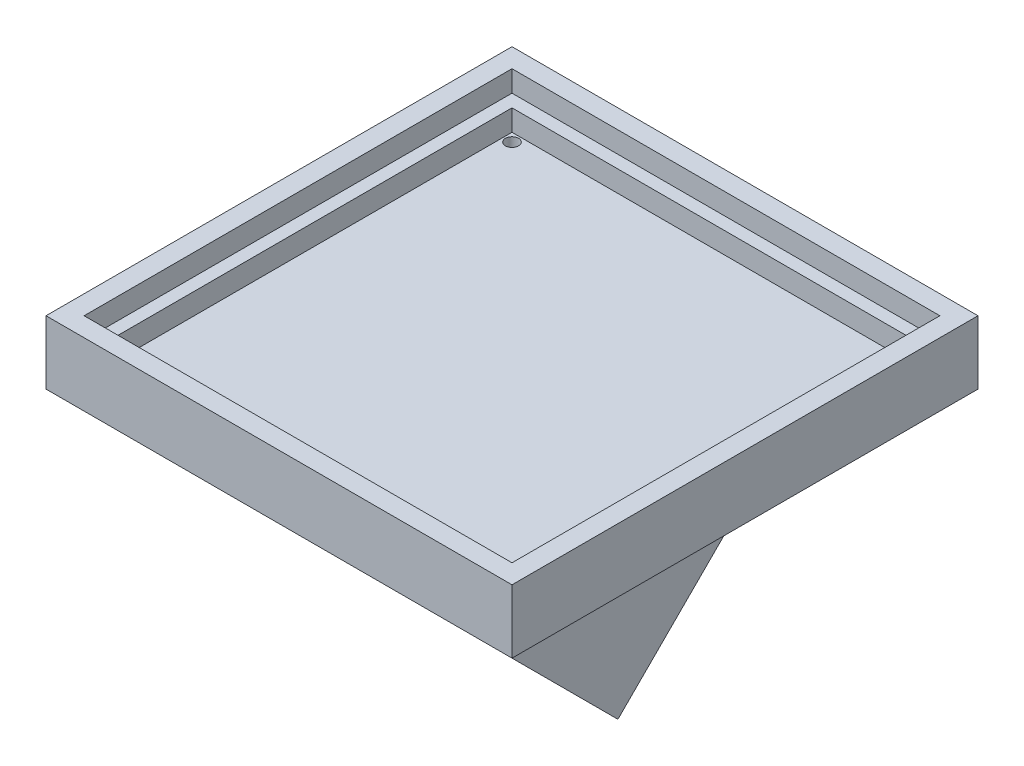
SolidWorks part; units mm, degrees
ref_plane "Front Plane" through (0, 0, 0) normal (0, 0, 1) x (1, 0, 0)
ref_plane "Top Plane" through (0, 0, 0) normal (0, 1, 0) x (1, 0, 0)
ref_plane "Right Plane" through (0, 0, 0) normal (1, 0, 0) x (0, 0, -1)
sketch "Sketch1" plane through (0, 0, 0) normal (0, 1, 0) x (1, 0, 0)
  line L1 (-55, -55) -> (55, -55)
  line L2 (-55, -55) -> (-55, 55)
  line L3 (-55, 55) -> (55, 55)
  line L4 (55, -55) -> (55, 55)
  line L5 (-55, -55) -> (55, 55) construction
  line L6 (-55, 55) -> (55, -55) construction
  point P0 (0, 0)
  dimension "D1" = 110
  dimension "D2" = 110
extrude "Boss-Extrude1" add sketch "Sketch1" along normal mid plane 15
sketch "Sketch2" plane through (0, 7.5, 0) normal (0, 1, 0) x (1, 0, 0)
  line L13 (-50.5, -50.5) -> (50.5, -50.5)
  line L14 (-50.5, -50.5) -> (-50.5, 50.5)
  line L15 (-50.5, 50.5) -> (50.5, 50.5)
  line L16 (50.5, -50.5) -> (50.5, 50.5)
  line L17 (-50.5, -50.5) -> (50.5, 50.5) construction
  line L18 (-50.5, 50.5) -> (50.5, -50.5) construction
  point P0 (0, 0)
  dimension "D2" = 101
  dimension "D1" = 101
extrude "Cut-Extrude1" cut sketch "Sketch2" against normal blind 5 contours L13 L16 L15 L14
sketch "Sketch3" plane through (0, 2.5, 0) normal (0, 1, 0) x (1, 0, 0)
  line L0 (-50.5, 50.5) -> (50.5, 50.5) construction
  line L1 (-50.5, -50.5) -> (-50.5, 50.5) construction
  line L2 (50.5, -50.5) -> (50.5, 50.5) construction
  line L3 (-50.5, -50.5) -> (-50.5, 50.5) construction
  line L4 (-50.5, -50.5) -> (50.5, -50.5) construction
  circle A0 centre (-45.5, 45.5) radius 1.55
  circle A1 centre (45.55, 44.91) radius 1.55
  circle A2 centre (45.5, -45.26) radius 1.55
  circle A3 centre (-45.47, -45.09) radius 1.55
  dimension "D1" = 3.1
  dimension "D2" = 5
  dimension "D3" = 5
  dimension "D4" = 5.59
  dimension "D5" = 4.95
  dimension "D6" = 5.03
  dimension "D7" = 5.41
  dimension "D8" = 5
  dimension "D9" = 5.24
extrude "Cut-Extrude2" cut sketch "Sketch3" against normal through all
sketch "Sketch4" plane through (0, 2.5, 0) normal (0, 1, 0) x (1, 0, 0)
  line L1 (-47.5, -47.5) -> (47.5, -47.5)
  line L2 (-47.5, -47.5) -> (-47.5, 47.5)
  line L3 (-47.5, 47.5) -> (47.5, 47.5)
  line L4 (47.5, -47.5) -> (47.5, 47.5)
  line L5 (-47.5, -47.5) -> (47.5, 47.5) construction
  line L6 (-47.5, 47.5) -> (47.5, -47.5) construction
  point P0 (0, 0)
  dimension "D1" = 95
  dimension "D2" = 95
extrude "Cut-Extrude3" cut sketch "Sketch4" against normal blind 5
sketch "Sketch5" plane through (0, -7.5, 0) normal (0, -1, 0) x (1, 0, 0)
  line L1 (-47.149, 47.9539) -> (-48.7897, 45.0678)
  line L2 (-48.7897, 45.0678) -> (-47.1107, 42.204)
  line L3 (-47.1107, 42.204) -> (-43.791, 42.2261)
  line L4 (-43.791, 42.2261) -> (-42.1503, 45.1122)
  line L5 (-42.1503, 45.1122) -> (-43.8293, 47.976)
  line L6 (-43.8293, 47.976) -> (-47.149, 47.9539)
  line L7 (47.1798, 48.1234) -> (43.8601, 48.1465)
  line L8 (43.8601, 48.1465) -> (42.1803, 45.2831)
  line L9 (42.1803, 45.2831) -> (43.8202, 42.3966)
  line L10 (43.8202, 42.3966) -> (47.1399, 42.3735)
  line L11 (47.1399, 42.3735) -> (48.8197, 45.2369)
  line L12 (48.8197, 45.2369) -> (47.1798, 48.1234)
  line L13 (-48.6847, -46.4374) -> (-46.2805, -48.7267)
  line L14 (-46.2805, -48.7267) -> (-43.0958, -47.7893)
  line L15 (-43.0958, -47.7893) -> (-42.3153, -44.5626)
  line L16 (-42.3153, -44.5626) -> (-44.7195, -42.2733)
  line L17 (-44.7195, -42.2733) -> (-47.9042, -43.2107)
  line L18 (-47.9042, -43.2107) -> (-48.6847, -46.4374)
  line L19 (48.7339, -45.8498) -> (47.9559, -42.6225)
  line L20 (47.9559, -42.6225) -> (44.772, -41.6827)
  line L21 (44.772, -41.6827) -> (42.3661, -43.9702)
  line L22 (42.3661, -43.9702) -> (43.1441, -47.1975)
  line L23 (43.1441, -47.1975) -> (46.328, -48.1373)
  line L24 (46.328, -48.1373) -> (48.7339, -45.8498)
  circle A0 centre (-45.47, 45.09) radius 2.875 construction
  circle A1 centre (45.5, 45.26) radius 2.875 construction
  circle A2 centre (-45.5, -45.5) radius 2.875 construction
  circle A3 centre (45.55, -44.91) radius 2.875 construction
  dimension "D1" = 5.75
extrude "Cut-Extrude4" cut sketch "Sketch5" against normal blind 2.3
sketch "Sketch6" plane through (0, 0, 0) normal (1, 0, 0) x (0, 0, -1)
  line L1 (0, -62.5) -> (-55, -7.5)
  line L6 (55, -7.5) -> (0, -62.5)
  line L7 (-55, -7.5) -> (55, -7.5) construction
  line L8 (55, -7.5) -> (-55, -7.5)
  dimension "D1" = 45
  dimension "D2" = 45
extrude "Boss-Extrude2" add sketch "Sketch6" along normal mid plane 50
